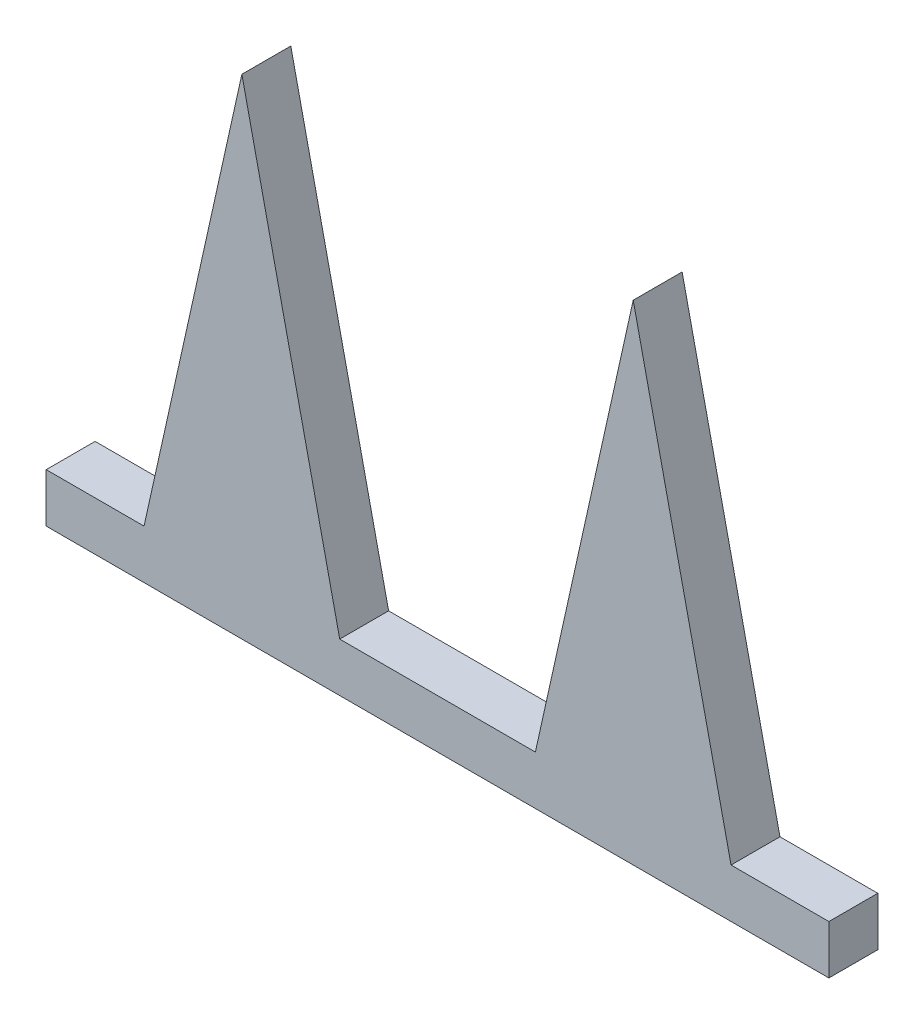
SolidWorks part; units mm, degrees
ref_plane "Front Plane" through (0, 0, 0) normal (0, 0, 1) x (1, 0, 0)
ref_plane "Top Plane" through (0, 0, 0) normal (0, 1, 0) x (1, 0, 0)
ref_plane "Right Plane" through (0, 0, 0) normal (1, 0, 0) x (0, 0, -1)
sketch "Sketch1" plane through (0, 0, 0) normal (0, 0, 1) x (1, 0, 0)
  line L0 (20, 10) -> (40, 100)
  line L1 (0, 0) -> (160, 0)
  line L2 (0, 0) -> (0, 10)
  line L3 (0, 10) -> (20, 10)
  line L4 (160, 0) -> (160, 10)
  line L5 (40, 100) -> (60, 10)
  line L6 (100, 10) -> (120, 100)
  line L7 (120, 100) -> (140, 10)
  line L8 (60, 10) -> (100, 10)
  line L9 (140, 10) -> (160, 10)
  dimension "D1" = 160
  dimension "D2" = 10
  dimension "D3" = 20
  dimension "D4" = 40
  dimension "D5" = 90
  dimension "D6" = 20
extrude "Extrude1" add sketch "Sketch1" along normal blind 10
